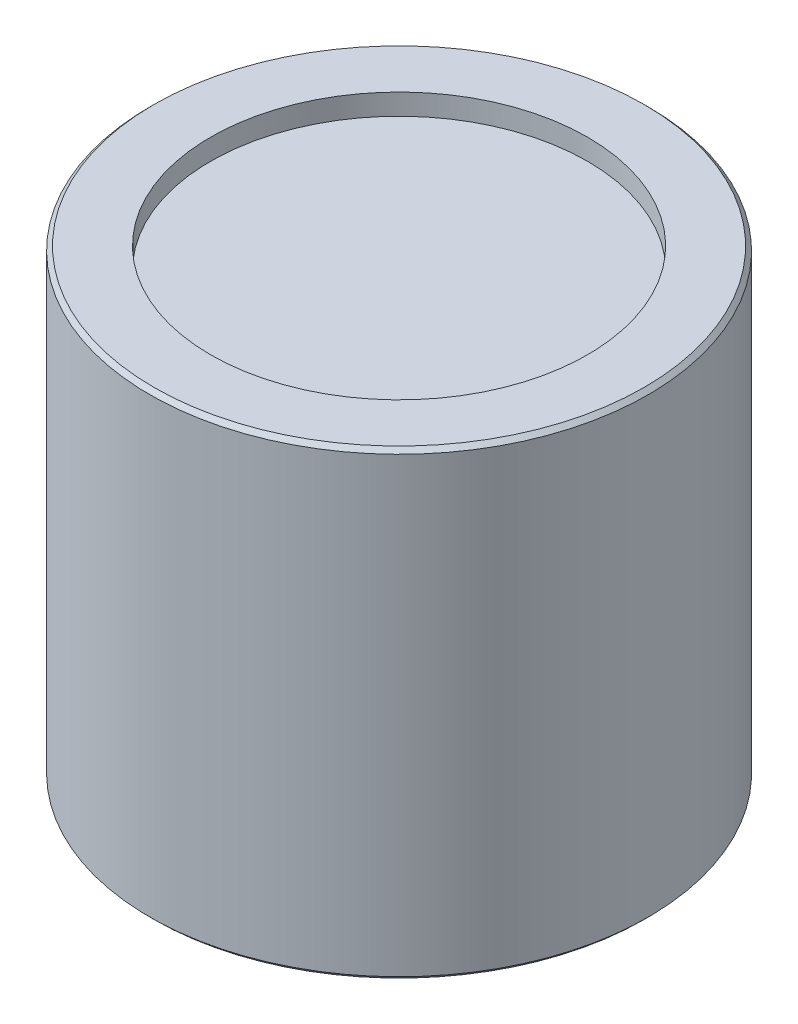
SolidWorks part; units mm, degrees
ref_plane "Ön Düzlem" through (0, 0, 0) normal (0, 0, 1) x (1, 0, 0)
ref_plane "Üst Düzlem" through (0, 0, 0) normal (0, 1, 0) x (1, 0, 0)
ref_plane "Sağ Düzlem" through (0, 0, 0) normal (1, 0, 0) x (0, 0, -1)
sketch "Çizim1" plane through (0, 0, 0) normal (1, 0, 0) x (0, 0, -1)
  line L1 (0, 0) -> (-45, 0)
  line L2 (0, 0) -> (0, 7)
  line L3 (0, 7) -> (-45, 7)
  line L4 (-45, 0) -> (-45, 7)
  line L5 (0, 7) -> (-59.5, 7)
  line L6 (0, 7) -> (0, 117)
  line L7 (0, 117) -> (-59.5, 117)
  line L8 (-59.5, 7) -> (-59.5, 117)
  dimension "D1" = 110
  dimension "D2" = 59.5
  dimension "D3" = 45
  dimension "D4" = 7
revolve "Döndür1" add sketch "Çizim1" angle 360 about L6
chamfer "Pah1" distance 1 angle 45 2 edges at (0, 7, -59.5) (0, 117, -59.5)
sketch "Çizim2" plane through (0, 117, 0) normal (0, 1, 0) x (1, 0, 0)
  circle A0 centre (0, 0) radius 45
extrude "Kes-Ekstrüzyon1" cut sketch "Çizim2" against normal blind 5
